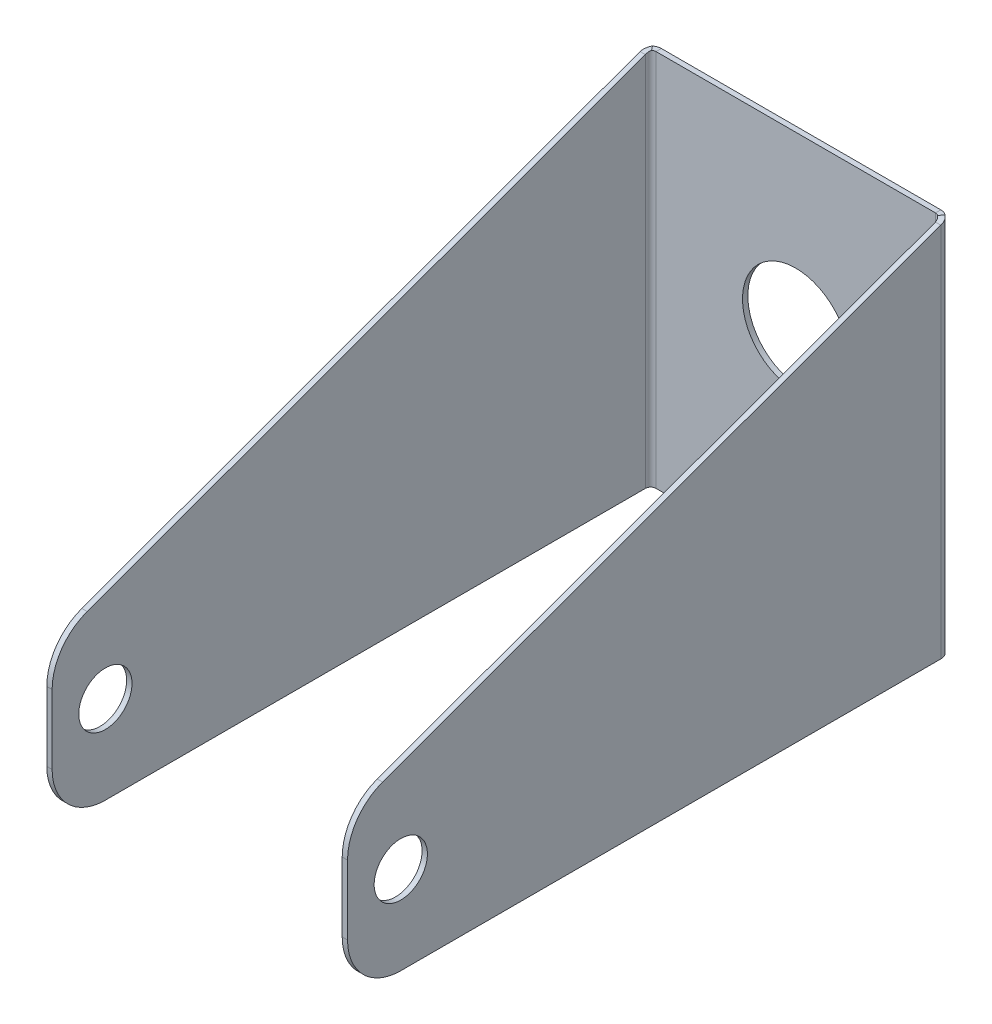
SolidWorks part; units mm, degrees
ref_plane "Front Plane" through (0, 0, 0) normal (0, 0, 1) x (1, 0, 0)
ref_plane "Top Plane" through (0, 0, 0) normal (0, 1, 0) x (1, 0, 0)
ref_plane "Right Plane" through (0, 0, 0) normal (1, 0, 0) x (0, 0, -1)
sketch "Sketch1" plane through (0, 0, 0) normal (0, 0, 1) x (1, 0, 0)
  line L0 (-130, 0) -> (130, 0)
  line L1 (140, 10) -> (140, 22.9979)
  line L2 (133.4202, 32.3949) -> (27.2369, 71.0424)
  line L3 (27.2369, 71.0424) -> (-27.2369, 71.0424)
  line L4 (-27.2369, 71.0424) -> (-133.4202, 32.3949)
  line L5 (-140, 22.9979) -> (-140, 10)
  line L6 (0, 71.0424) -> (0, 6.8404) construction
  arc A0 (130, 0) -> (140, 10) centre (130, 10) ccw
  arc A1 (-140, 10) -> (-130, 0) centre (-130, 10) ccw
  arc A2 (-133.4202, 32.3949) -> (-140, 22.9979) centre (-130, 22.9979) ccw
  arc A3 (140, 22.9979) -> (133.4202, 32.3949) centre (130, 22.9979) ccw
  circle A4 centre (-130, 16.5) radius 5
  circle A5 centre (130, 16.5) radius 5
  circle A6 centre (0, 38.9414) radius 10
  point P10 (-140, 0)
  point P14 (-140, 30)
  dimension "D6" = 10
  dimension "D7" = 10
  dimension "D9" = 20
  dimension "D1" = 280
  dimension "D2" = 30
  dimension "D3" = 110
  dimension "D4" = 110
  dimension "D5" = 120
  dimension "D8" = 6.5
sheet metal parameters "Sheet-Metal3" thickness 1 parameters "D1"=1
base flange "Base-Flange3" sketch "Sketch1" thickness 1 reverse thickness direction yes parameters "D1"=1
sketch "Sketch6" plane through (0, 0, 1) normal (0, 0, 1) x (1, 0, 0)
  line L0 (-27.2369, 71.0424) -> (-27.2369, 0)
  line L1 (-130, 0) -> (130, 0) construction
  line L3 (27.2369, 71.0424) -> (27.2369, 0)
sketched bend "Sketched Bend2" parameters "D1"=0
bend "SketchBend3" bend radius 1 bend angle 90 parameters "D5"=1
bend "SketchBend4" bend radius 0 bend angle 90 parameters "D5"=2
flat pattern "Flat-Pattern3"
sketch "Bend-Lines3" plane through (0, 0, 0) normal (0, 1, 0) x (-1, 0, 0)
bend of the flat pattern "Flatten-<SketchBend3>1"
bend of the flat pattern "Flatten-<SketchBend4>1"
